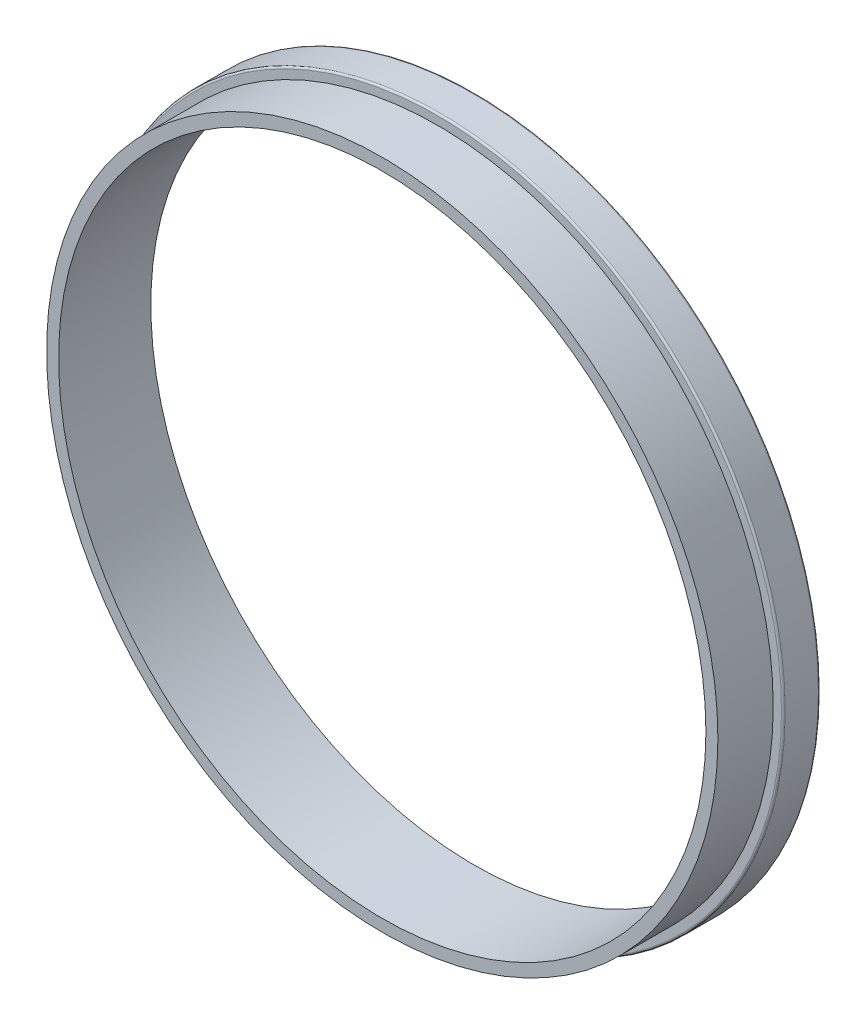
SolidWorks part; units mm, degrees
ref_plane "前视基准面" through (0, 0, 0) normal (0, 0, 1) x (1, 0, 0)
ref_plane "上视基准面" through (0, 0, 0) normal (0, 1, 0) x (1, 0, 0)
ref_plane "右视基准面" through (0, 0, 0) normal (1, 0, 0) x (0, 0, -1)
sketch "草图1" plane through (0, 0, 0) normal (0, 0, 1) x (1, 0, 0)
  circle A0 centre (0, 0) radius 37.5
  circle A1 centre (0, 0) radius 35.1
  dimension "D1" = 70.2
  dimension "D2" = 75
extrude "凸台-拉伸1" add sketch "草图1" along normal blind 10
sketch "草图2" plane through (0, 0, 10) normal (0, 0, 1) x (1, 0, 0)
  circle A0 centre (0, 0) radius 36.4
  dimension "D1" = 72.8
extrude "切除-拉伸1" cut sketch "草图2" against normal offset from surface (6 mm away) 4 flip side to cut
fillet "圆角1" radius 0.2 2 edges at (37.5, 0, 4) (37.5, 0, 0)
